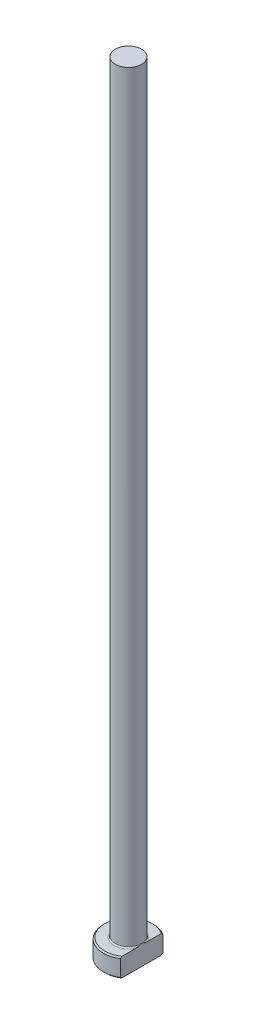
SolidWorks part; units mm, degrees
ref_plane "Front Plane" through (0, 0, 0) normal (0, 0, 1) x (1, 0, 0)
ref_plane "Top Plane" through (0, 0, 0) normal (0, 1, 0) x (1, 0, 0)
ref_plane "Right Plane" through (0, 0, 0) normal (1, 0, 0) x (0, 0, -1)
sketch "Sketch1" plane through (0, 0, 0) normal (0, 0, 1) x (1, 0, 0)
  line L0 (0, 259.9588) -> (0, -15.1925) construction
  line L1 (0, 0) -> (-4, 0)
  line L2 (-4, 0) -> (-4, 3)
  line L3 (-4, 3) -> (-2.1, 3)
  line L4 (-2.1, 3) -> (-2.1, 125)
  line L5 (-2.1, 125) -> (0, 125)
  line L6 (0, 125) -> (0, 0)
  dimension "L" = 125
  dimension "H" = 8
  dimension "T" = 3
  dimension "D" = 4.2
revolve "Revolve1" add sketch "Sketch1" angle 360 about L0
chamfer "Chamfer1" distance 0.2 angle 45 2 edges at (0, 3, 4) (0, 0, 4)
fillet "Fillet1" radius 0.2 1 edges at (0, 3, 2.1)
sketch "Sketch2" plane through (0, 0, 0) normal (0, 1, 0) x (1, 0, 0)
  line L0 (2.1, 3.4044) -> (2.1, -3.4044)
  circle A0 centre (0, 0) radius 4 construction
  arc A1 (2.1, -3.4044) -> (2.1, 3.4044) centre (0, 0) ccw
  circle A2 centre (0, 0) radius 2.1 construction
extrude "KEY" cut sketch "Sketch2" along normal through all
